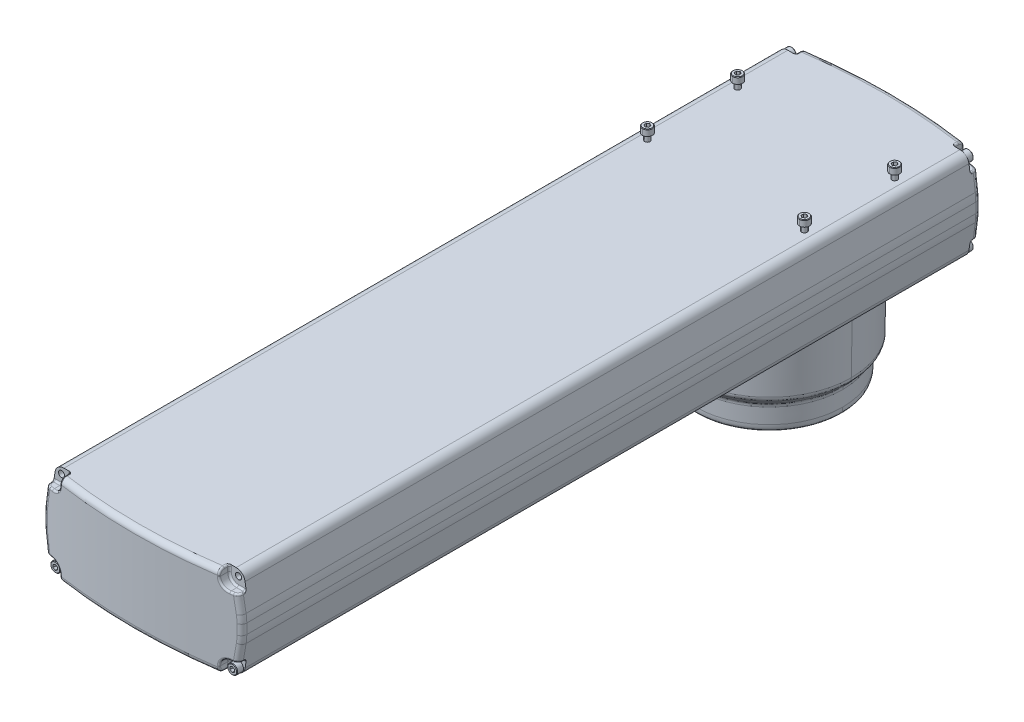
SolidWorks part; units mm, degrees
ref_plane "前视基准面" through (0, 0, 0) normal (0, 0, 1) x (1, 0, 0)
ref_plane "上视基准面" through (0, 0, 0) normal (0, 1, 0) x (1, 0, 0)
ref_plane "右视基准面" through (0, 0, 0) normal (1, 0, 0) x (0, 0, -1)
imported_body "输入1"
other "移动面1" parameters "D1"=10
